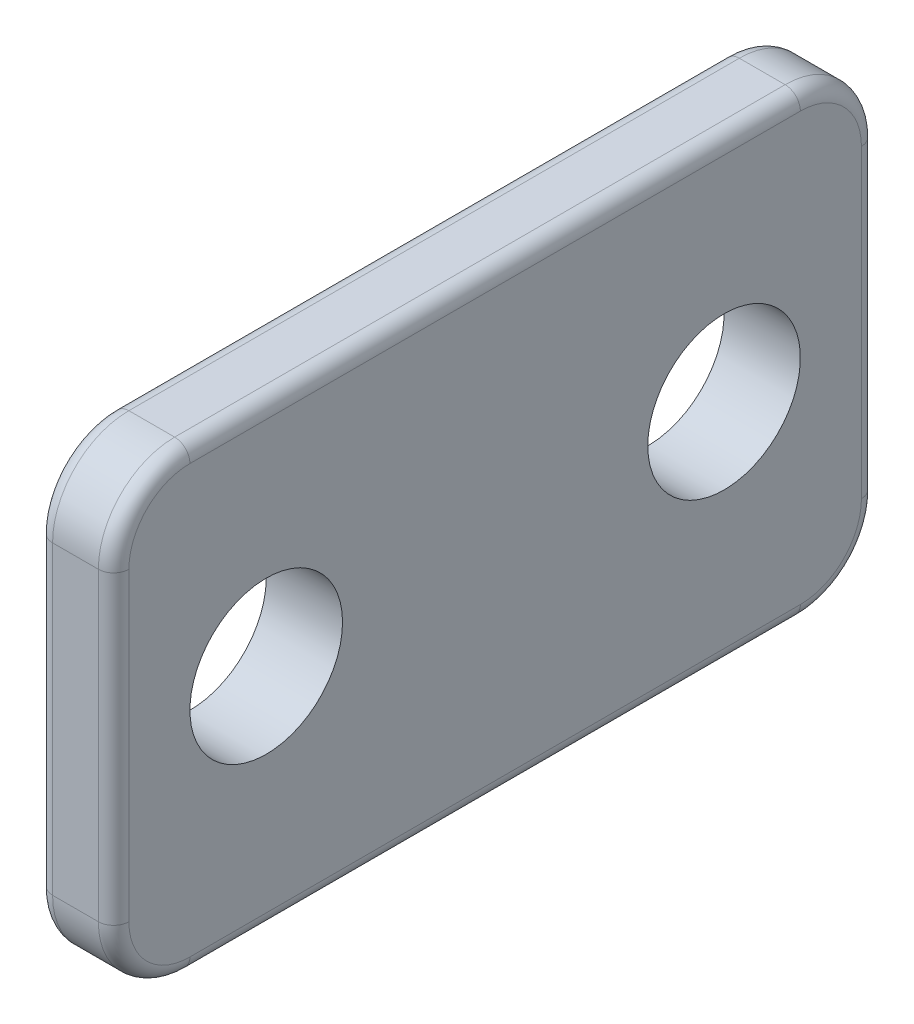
SolidWorks part; units mm, degrees
ref_plane "Front Plane" through (0, 0, 0) normal (0, 0, 1) x (1, 0, 0)
ref_plane "Top Plane" through (0, 0, 0) normal (0, 1, 0) x (1, 0, 0)
ref_plane "Right Plane" through (0, 0, 0) normal (1, 0, 0) x (0, 0, -1)
sketch "Sketch1" plane through (0, 0, 0) normal (1, 0, 0) x (0, 0, -1)
  line L0 (-25, 0) -> (25, 0) construction
  line L1 (-20, 15) -> (20, 15)
  line L2 (-25, 10) -> (-25, -10)
  line L3 (-20, -15) -> (20, -15)
  line L4 (25, 10) -> (25, -10)
  line L5 (-25, 15) -> (25, -15) construction
  line L6 (-25, -15) -> (25, 15) construction
  line L7 (0, 0) -> (0, -28.4617) construction
  arc A0 (20, 15) -> (25, 10) centre (20, 10) cw
  arc A1 (20, -15) -> (25, -10) centre (20, -10) ccw
  arc A2 (-25, -10) -> (-20, -15) centre (-20, -10) ccw
  arc A3 (-20, 15) -> (-25, 10) centre (-20, 10) ccw
  circle A4 centre (-15, 0) radius 5
  circle A5 centre (15, 0) radius 5
  point P0 (0, 0)
  dimension "D3" = 5
  dimension "D4" = 10
  dimension "D5" = 15
  dimension "D1" = 30
  dimension "D2" = 50
extrude "Boss-Extrude1" add sketch "Sketch1" along normal mid plane 5
fillet "Fillet1" radius 1 16 edges at (-2.5, 13.5355, -23.5355) (-2.5, 0, -25) (-2.5, -13.5355, -23.5355) (-2.5, -15, 0) (-2.5, -13.5355, 23.5355) (-2.5, 0, 25) (-2.5, 13.5355, 23.5355) (2.5, 13.5355, -23.5355) (2.5, 0, -25) (2.5, -13.5355, -23.5355) (2.5, -15, 0) (2.5, -13.5355, 23.5355) (2.5, 0, 25) (2.5, 13.5355, 23.5355) (-2.5, 15, 0) (2.5, 15, 0)
